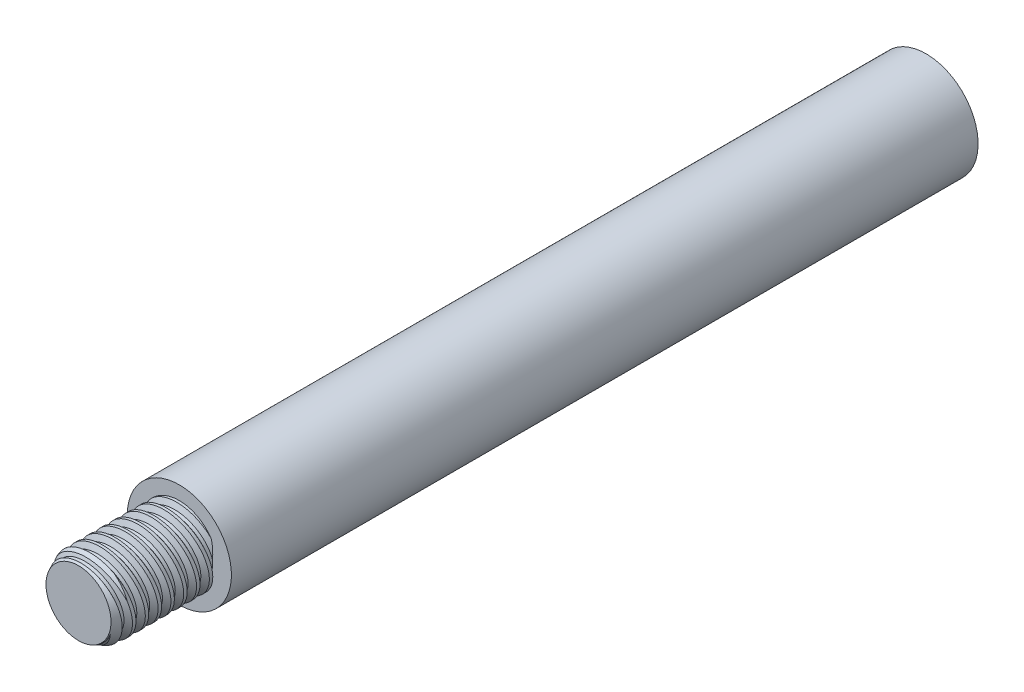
SolidWorks part; units mm, degrees
ref_plane "Front" through (0, 0, 0) normal (0, 0, 1) x (1, 0, 0)
ref_plane "Top" through (0, 0, 0) normal (0, 1, 0) x (1, 0, 0)
ref_plane "Right" through (0, 0, 0) normal (1, 0, 0) x (0, 0, -1)
sketch "Sketch1" plane through (0, 0, 0) normal (1, 0, 0) x (0, 0, -1)
  line L0 (-77.851, 0) -> (77.851, 0) construction
  line L1 (-77.851, 0) -> (-77.851, -25.4) construction
  line L2 (-27.813, 0) -> (-27.813, -9.525) construction
  line L3 (77.851, -25.4) -> (77.851, 0) construction
  line L4 (69.977, 0) -> (69.977, 9.525)
  line L5 (-19.939, 4.214) -> (-19.939, 9.525)
  line L6 (-69.977, 0) -> (-69.977, 4.064) construction
  line L7 (-69.977, 4.064) -> (-19.939, 4.064) construction
  line L8 (-19.939, 9.525) -> (69.977, 9.525)
  line L9 (-77.851, -25.4) -> (-19.939, -25.4) construction
  line L10 (-19.939, -25.4) -> (77.851, -25.4) construction
  line L11 (38.3667, 0) -> (69.977, 0)
  line L12 (-19.939, 4.214) -> (30.099, 4.214)
  line L13 (30.099, 4.214) -> (30.099, 0) construction
  line L14 (30.099, 4.214) -> (38.3667, 4.214)
  line L15 (38.3667, 4.214) -> (38.3667, 0)
  line L16 (-19.939, 4.214) -> (-19.939, 4.064) construction
  line L17 (-19.939, -9.525) -> (69.977, -9.525) construction
  line L18 (-69.977, -4.064) -> (-19.939, -4.064) construction
  line L19 (-19.939, 4.064) -> (-19.939, -9.525) construction
  line L20 (-19.939, -9.525) -> (-27.813, -9.525) construction
  line L21 (-19.939, -9.525) -> (-19.939, -25.4) construction
  point P9 (28.956, -25.4)
revolve "Revolve1" add sketch "Sketch1" angle 360 about L0
ref_plane "Plane1" through (0, 0, -28.956) normal (0, 0, 1) x (1, 0, 0)
fillet "Fillet2" radius 1.0622 2 edges at (9.525, 0, -69.977) (9.525, 0, 19.939)
sketch "Sketch2" plane through (0, 0, 0) normal (1, 0, 0) x (0, 0, -1)
  line L0 (77.851, 3) -> (69.977, 3)
  line L1 (69.977, 0) -> (129.3293, 0) construction
  line L2 (69.977, 0) -> (69.977, 3)
  line L3 (69.977, 0) -> (77.851, 0)
  line L5 (69.977, 0) -> (69.977, 9.525) construction
  line L8 (69.977, 0) -> (69.977, -3) construction
  line L10 (77.851, 3) -> (77.851, 0)
  line L12 (77.851, -3) -> (69.977, -3) construction
  line L13 (77.851, -25.4) -> (77.851, 0) construction
  dimension "Thread Dia" = 6
revolve "Revolve2" add sketch "Sketch2" angle 360 about L1
sketch "Sketch12" plane through (0, 0, 0) normal (1, 0, 0) x (0, 0, -1)
  line L0 (69.977, 3) -> (69.977, -3) construction
  line L1 (69.977, -3) -> (70.977, -3) construction
  line L2 (70.977, -3) -> (69.977, 3) construction
  line L3 (69.977, 3) -> (70.1003, 3.0205) construction
  line L4 (70.1003, 3.0205) -> (70.9634, 3.1644)
  line L5 (70.9634, 3.1644) -> (70.7441, 2.5791)
  line L6 (70.7441, 2.5791) -> (70.4975, 2.538)
  line L7 (70.4975, 2.538) -> (70.1003, 3.0205)
  line L8 (70.5318, 3.0925) -> (70.6208, 2.5586) construction
  line L9 (69.977, 3) -> (70.5473, 3) construction
  line L10 (70.5473, 3) -> (71.5473, -3) construction
  line L11 (71.5473, -3) -> (70.977, -3) construction
  line L12 (69.977, -0.1784) -> (72.1175, 0.1784) construction
  line L13 (77.851, -3) -> (69.977, -3) construction
  line L14 (77.851, 3) -> (69.977, 3) construction
  line L15 (69.977, 0) -> (69.977, 3) construction
  point P13 (71.0473, 0)
revolve "Cut-Revolve1" cut sketch "Sketch12" angle 360 about L12
sketch "Sketch13" plane through (0, 0, 0) normal (1, 0, 0) x (0, 0, -1)
  line L0 (76.8603, 3) -> (77.851, 3)
  line L1 (77.851, 3) -> (77.851, 2.538)
  line L2 (77.851, 2.538) -> (76.8603, 3)
  line L3 (77.851, 3) -> (69.977, 3) construction
  line L4 (77.851, 3) -> (77.851, 0) construction
  line L5 (70.4975, 2.538) -> (77.851, 2.538) construction
  line L6 (69.977, 0) -> (77.851, 0) construction
  line L7 (69.977, 0) -> (77.851, 0) construction
  dimension "D1" = 25
revolve "Cut-Revolve2" cut sketch "Sketch13" angle 360 about L7
pattern_linear "LPattern4" count 2 spacing 1 along (0, 0, 1) count 8 spacing 1 along (0, 0, -1) of "Cut-Revolve1"
sketch "Sketch9" plane through (0, 0, 0) normal (1, 0, 0) x (0, 0, -1)
  line L0 (-69.977, 0) -> (-69.977, 4.064) construction
  line L2 (-69.977, 0) -> (-69.977, 4.064)
  line L3 (-69.977, 4.064) -> (-11.6713, 4.064)
  line L4 (-11.6713, 4.064) -> (-11.6713, 0)
  line L5 (-11.6713, 0) -> (-69.977, 0)
  line L6 (-69.977, 0) -> (-77.851, 0) construction
  line L8 (-11.6713, 2.032) -> (-19.939, 2.032) construction
  line L9 (-19.939, 2.032) -> (-19.939, 4.064) construction
  line L10 (30.099, 4.214) -> (38.3667, 4.214) construction
revolve "Revolve5" add sketch "Sketch9" angle 360 about L6
sketch "Sketch15" plane through (0, 0, 0) normal (1, 0, 0) x (0, 0, -1)
  line L0 (-77.851, 0) -> (-77.851, -25.4) construction
  line L1 (-69.977, 0) -> (-77.851, 0)
  line L2 (-69.977, 0) -> (-69.977, 3)
  line L3 (-69.977, 3) -> (-77.851, 3)
  line L4 (-77.851, 0) -> (-77.851, 3)
  line L5 (77.851, 3) -> (69.977, 3) construction
  line L6 (-69.977, 0) -> (-66.977, 0) construction
  line L7 (-69.977, -3) -> (-77.851, -3) construction
revolve "Revolve6" add sketch "Sketch15" angle 360 about L6
sketch "Sketch16" plane through (0, 0, 0) normal (1, 0, 0) x (0, 0, -1)
  line L0 (-69.977, -3) -> (-69.977, 3) construction
  line L1 (-69.977, 3) -> (-70.977, 3) construction
  line L2 (-70.977, 3) -> (-69.977, -3) construction
  line L3 (-69.977, -3) -> (-70.1003, -3.0205) construction
  line L4 (-70.1003, -3.0205) -> (-70.9634, -3.1644)
  line L5 (-70.9634, -3.1644) -> (-70.7441, -2.5791)
  line L6 (-70.7441, -2.5791) -> (-70.4975, -2.538)
  line L7 (-70.4975, -2.538) -> (-70.1003, -3.0205)
  line L8 (-70.6208, -2.5586) -> (-70.5318, -3.0925) construction
  line L9 (-69.977, -3) -> (-70.5473, -3) construction
  line L10 (-70.5473, -3) -> (-71.5473, 3) construction
  line L11 (-71.5473, 3) -> (-70.977, 3) construction
  line L12 (-69.977, -3) -> (-77.851, -3) construction
  line L13 (-69.977, 3) -> (-77.851, 3) construction
  line L14 (-69.977, 0.1784) -> (-72.1175, -0.1784) construction
  line L16 (-69.977, 0) -> (-69.977, 3) construction
  point P17 (-71.0473, 0)
revolve "Cut-Revolve3" cut sketch "Sketch16" angle 360 about L14
sketch "Sketch17" plane through (0, 0, 0) normal (1, 0, 0) x (0, 0, -1)
  line L0 (-76.8603, -3) -> (-77.851, -3)
  line L1 (-77.851, -3) -> (-77.851, -2.538)
  line L2 (-77.851, -2.538) -> (-76.8603, -3)
  line L5 (-69.977, -3) -> (-77.851, -3) construction
  line L6 (-77.851, 0) -> (-77.851, 3) construction
  line L7 (-70.4975, -2.538) -> (-77.851, -2.538) construction
  line L8 (-69.977, 0) -> (-77.851, 0) construction
  line L9 (-69.977, 0) -> (-77.851, 0) construction
  dimension "D1" = 25
revolve "Cut-Revolve4" cut sketch "Sketch17" angle 360 about L9
pattern_linear "LPattern5" count 2 spacing 1 along (0, 0, -1) count 8 spacing 1 along (0, 0, 1) of "Cut-Revolve3"
combine bodies "Combine3" operation type add bodies to combine 143 108
combine bodies "Combine4" operation type add bodies to combine 148 122
pattern_linear "LPattern2" count 2 spacing 50.038 along (0, 0, -1)
sketch "Sketch14" plane through (0, 0, 0) normal (1, 0, 0) x (0, 0, -1)
  line L2 (-19.939, 3) -> (-20.1547, 3) construction
  line L3 (-20.1547, 3) -> (-20.3124, 2.5791) construction
  line L4 (-20.3124, 2.5791) -> (-20.559, 2.538) construction
  line L5 (-20.559, 2.538) -> (-20.9393, 3) construction
  line L10 (-20.9393, 3) -> (-21.1547, 3) construction
  line L11 (-21.1547, 3) -> (-21.3124, 2.5791) construction
  line L12 (-21.3124, 2.5791) -> (-21.559, 2.538) construction
  line L13 (-21.559, 2.538) -> (-21.9393, 3) construction
  line L14 (-21.9393, 3) -> (-22.1547, 3) construction
  line L15 (-22.1547, 3) -> (-22.3124, 2.5791) construction
  line L16 (-22.3124, 2.5791) -> (-22.559, 2.538) construction
  line L17 (-22.559, 2.538) -> (-22.9393, 3) construction
  line L18 (-22.9393, 3) -> (-23.1547, 3) construction
  line L19 (-23.1547, 3) -> (-23.3124, 2.5791) construction
  line L20 (-23.3124, 2.5791) -> (-23.559, 2.538) construction
  line L21 (-23.559, 2.538) -> (-23.9393, 3) construction
  line L22 (-23.9393, 3) -> (-24.1547, 3) construction
  line L23 (-24.1547, 3) -> (-24.3124, 2.5791) construction
  line L24 (-24.3124, 2.5791) -> (-24.559, 2.538) construction
  line L25 (-24.559, 2.538) -> (-24.9393, 3) construction
  line L26 (-24.9393, 3) -> (-25.1547, 3) construction
  line L27 (-25.1547, 3) -> (-25.3124, 2.5791) construction
  line L28 (-25.3124, 2.5791) -> (-25.559, 2.538) construction
  line L29 (-25.559, 2.538) -> (-25.9393, 3) construction
  line L43 (-25.9393, 3) -> (-26.1547, 3) construction
  line L44 (-26.1547, 3) -> (-26.3124, 2.5791) construction
  line L45 (-26.3124, 2.5791) -> (-26.559, 2.538) construction
  line L46 (-26.559, 2.538) -> (-26.9068, 2.9606) construction
  line L47 (-26.9068, 2.9606) -> (-27.2251, 2.8122) construction
  line L48 (-27.2251, 2.8122) -> (-27.3124, 2.5791) construction
  line L49 (-27.3124, 2.5791) -> (-27.559, 2.538) construction
  line L50 (-27.559, 2.538) -> (-27.6294, 2.6236) construction
  line L51 (-27.6294, 2.6236) -> (-27.813, 2.538) construction
  line L52 (-19.939, 3) -> (-20.1547, 3)
  line L53 (-20.1547, 3) -> (-20.3124, 2.5791)
  line L54 (-20.3124, 2.5791) -> (-20.559, 2.538)
  line L55 (-20.559, 2.538) -> (-20.9393, 3)
  line L56 (-20.9393, 3) -> (-21.1547, 3)
  line L57 (-21.1547, 3) -> (-21.3124, 2.5791)
  line L58 (-21.3124, 2.5791) -> (-21.559, 2.538)
  line L59 (-21.559, 2.538) -> (-21.9393, 3)
  line L60 (-21.9393, 3) -> (-22.1547, 3)
  line L61 (-22.1547, 3) -> (-22.3124, 2.5791)
  line L62 (-22.3124, 2.5791) -> (-22.559, 2.538)
  line L63 (-22.559, 2.538) -> (-22.9393, 3)
  line L64 (-22.9393, 3) -> (-23.1547, 3)
  line L65 (-23.1547, 3) -> (-23.3124, 2.5791)
  line L66 (-23.3124, 2.5791) -> (-23.559, 2.538)
  line L67 (-23.559, 2.538) -> (-23.9393, 3)
  line L68 (-23.9393, 3) -> (-24.1547, 3)
  line L69 (-24.1547, 3) -> (-24.3124, 2.5791)
  line L70 (-24.3124, 2.5791) -> (-24.559, 2.538)
  line L71 (-24.559, 2.538) -> (-24.9393, 3)
  line L72 (-24.9393, 3) -> (-25.1547, 3)
  line L73 (-25.1547, 3) -> (-25.3124, 2.5791)
  line L74 (-25.3124, 2.5791) -> (-25.559, 2.538)
  line L76 (-25.559, 2.538) -> (-25.9393, 3)
  line L77 (-25.9393, 3) -> (-26.1547, 3)
  line L78 (-26.1547, 3) -> (-26.3124, 2.5791)
  line L79 (-26.3124, 2.5791) -> (-26.559, 2.538)
  line L80 (-26.559, 2.538) -> (-26.9068, 2.9606)
  line L81 (-26.9068, 2.9606) -> (-27.2251, 2.8122)
  line L82 (-27.2251, 2.8122) -> (-27.3124, 2.5791)
  line L83 (-27.3124, 2.5791) -> (-27.559, 2.538)
  line L84 (-27.559, 2.538) -> (-27.6294, 2.6236)
  line L94 (-27.6294, 2.6236) -> (-27.813, 2.538)
  line L95 (-27.813, 2.538) -> (-27.813, -2.538) construction
  line L96 (-26.7061, -2.5791) -> (-26.4595, -2.538) construction
  line L97 (-26.8576, -2.9835) -> (-26.7061, -2.5791) construction
  line L98 (-27.2393, -2.8055) -> (-26.8576, -2.9835) construction
  line L99 (-27.4595, -2.538) -> (-27.2393, -2.8055) construction
  line L100 (-27.7061, -2.5791) -> (-27.4595, -2.538) construction
  line L108 (-27.813, -2.538) -> (-27.709, -2.5865) construction
  line L109 (-27.813, 2.538) -> (-27.813, -2.538)
  line L110 (-26.7061, -2.5791) -> (-26.4595, -2.538)
  line L111 (-26.8576, -2.9835) -> (-26.7061, -2.5791)
  line L112 (-27.2393, -2.8055) -> (-26.8576, -2.9835)
  line L113 (-27.4595, -2.538) -> (-27.2393, -2.8055)
  line L115 (-27.7061, -2.5791) -> (-27.4595, -2.538)
  line L116 (-27.813, -2.538) -> (-27.709, -2.5865)
  line L117 (-23.4595, -2.538) -> (-23.0792, -3) construction
  line L118 (-23.7061, -2.5791) -> (-23.4595, -2.538) construction
  line L119 (-23.8638, -3) -> (-23.7061, -2.5791) construction
  line L120 (-24.0792, -3) -> (-23.8638, -3) construction
  line L121 (-24.4595, -2.538) -> (-24.0792, -3) construction
  line L122 (-24.7061, -2.5791) -> (-24.4595, -2.538) construction
  line L123 (-24.8638, -3) -> (-24.7061, -2.5791) construction
  line L124 (-25.0792, -3) -> (-24.8638, -3) construction
  line L125 (-25.4595, -2.538) -> (-25.0792, -3) construction
  line L126 (-25.7061, -2.5791) -> (-25.4595, -2.538) construction
  line L127 (-25.8638, -3) -> (-25.7061, -2.5791) construction
  line L128 (-26.0792, -3) -> (-25.8638, -3) construction
  line L129 (-26.4595, -2.538) -> (-26.0792, -3) construction
  line L130 (-23.4595, -2.538) -> (-23.0792, -3)
  line L131 (-23.7061, -2.5791) -> (-23.4595, -2.538)
  line L132 (-23.8638, -3) -> (-23.7061, -2.5791)
  line L133 (-24.0792, -3) -> (-23.8638, -3)
  line L134 (-24.4595, -2.538) -> (-24.0792, -3)
  line L135 (-24.7061, -2.5791) -> (-24.4595, -2.538)
  line L136 (-24.8638, -3) -> (-24.7061, -2.5791)
  line L137 (-25.0792, -3) -> (-24.8638, -3)
  line L138 (-25.4595, -2.538) -> (-25.0792, -3)
  line L139 (-25.7061, -2.5791) -> (-25.4595, -2.538)
  line L140 (-25.8638, -3) -> (-25.7061, -2.5791)
  line L141 (-26.0792, -3) -> (-25.8638, -3)
  line L142 (-26.4595, -2.538) -> (-26.0792, -3)
  line L143 (-20.0792, -3) -> (-19.939, -3) construction
  line L144 (-20.4595, -2.538) -> (-20.0792, -3) construction
  line L145 (-20.7061, -2.5791) -> (-20.4595, -2.538) construction
  line L146 (-20.8638, -3) -> (-20.7061, -2.5791) construction
  line L147 (-21.0792, -3) -> (-20.8638, -3) construction
  line L148 (-21.4595, -2.538) -> (-21.0792, -3) construction
  line L152 (-21.7061, -2.5791) -> (-21.4595, -2.538) construction
  line L154 (-21.8638, -3) -> (-21.7061, -2.5791) construction
  line L157 (-22.0792, -3) -> (-21.8638, -3) construction
  line L160 (-22.4595, -2.538) -> (-22.0792, -3) construction
  line L165 (-22.7061, -2.5791) -> (-22.4595, -2.538) construction
  line L166 (-22.8638, -3) -> (-22.7061, -2.5791) construction
  line L167 (-23.0792, -3) -> (-22.8638, -3) construction
  line L168 (-20.0792, -3) -> (-19.939, -3)
  line L169 (-20.4595, -2.538) -> (-20.0792, -3)
  line L170 (-20.7061, -2.5791) -> (-20.4595, -2.538)
  line L171 (-20.8638, -3) -> (-20.7061, -2.5791)
  line L172 (-21.0792, -3) -> (-20.8638, -3)
  line L173 (-21.4595, -2.538) -> (-21.0792, -3)
  line L174 (-21.7061, -2.5791) -> (-21.4595, -2.538)
  line L175 (-21.8638, -3) -> (-21.7061, -2.5791)
  line L176 (-22.0792, -3) -> (-21.8638, -3)
  line L190 (-22.4595, -2.538) -> (-22.0792, -3)
  line L191 (-22.7061, -2.5791) -> (-22.4595, -2.538)
  line L192 (-22.8638, -3) -> (-22.7061, -2.5791)
  line L193 (-23.0792, -3) -> (-22.8638, -3)
  line L194 (-27.559, 2.538) -> (-26.7061, -2.5791) construction
  line L195 (-27.559, 2.538) -> (-26.7061, -2.5791)
  line L196 (-27.3124, 2.5791) -> (-26.4595, -2.538) construction
  line L197 (-27.3124, 2.5791) -> (-26.4595, -2.538)
  line L198 (-24.3124, 2.5791) -> (-23.4595, -2.538) construction
  line L199 (-24.559, 2.538) -> (-23.7061, -2.5791) construction
  line L200 (-25.3124, 2.5791) -> (-24.4595, -2.538) construction
  line L201 (-25.559, 2.538) -> (-24.7061, -2.5791) construction
  line L202 (-26.559, 2.538) -> (-25.7061, -2.5791) construction
  line L216 (-26.3124, 2.5791) -> (-25.4595, -2.538) construction
  line L217 (-24.3124, 2.5791) -> (-23.4595, -2.538)
  line L218 (-24.559, 2.538) -> (-23.7061, -2.5791)
  line L219 (-25.3124, 2.5791) -> (-24.4595, -2.538)
  line L220 (-25.559, 2.538) -> (-24.7061, -2.5791)
  line L221 (-26.559, 2.538) -> (-25.7061, -2.5791)
  line L222 (-26.3124, 2.5791) -> (-25.4595, -2.538)
  line L223 (-19.939, 0.3388) -> (-20.3124, 2.5791) construction
  line L224 (-19.939, -1.1819) -> (-20.559, 2.538) construction
  line L225 (-21.3124, 2.5791) -> (-20.4595, -2.538) construction
  line L226 (-21.559, 2.538) -> (-20.7061, -2.5791) construction
  line L227 (-22.3124, 2.5791) -> (-21.4595, -2.538) construction
  line L228 (-22.559, 2.538) -> (-21.7061, -2.5791) construction
  line L229 (-23.3124, 2.5791) -> (-22.4595, -2.538) construction
  line L230 (-23.559, 2.538) -> (-22.7061, -2.5791) construction
  line L232 (-19.939, 0.3388) -> (-20.3124, 2.5791)
  line L234 (-19.939, -1.1819) -> (-20.559, 2.538)
  line L235 (-21.3124, 2.5791) -> (-20.4595, -2.538)
  line L237 (-21.559, 2.538) -> (-20.7061, -2.5791)
  line L238 (-22.3124, 2.5791) -> (-21.4595, -2.538)
  line L239 (-22.559, 2.538) -> (-21.7061, -2.5791)
  line L240 (-23.3124, 2.5791) -> (-22.4595, -2.538)
  line L242 (-23.559, 2.538) -> (-22.7061, -2.5791)
  line L244 (-27.7212, -0.9682) -> (-27.4595, -2.538) construction
  line L254 (-27.7212, -0.9682) -> (-27.4595, -2.538)
  line L255 (-27.6294, 2.6236) -> (-26.8576, -2.9835)
  line L256 (-27.2393, -2.8055) -> (-27.7212, -0.9682)
  line L257 (-26.0792, -3) -> (-27.2251, 2.8122)
  line L258 (-26.9068, 2.9606) -> (-25.8638, -3)
  line L259 (-25.0792, -3) -> (-26.1547, 3)
  line L260 (-25.9393, 3) -> (-24.8638, -3)
  line L261 (-24.0792, -3) -> (-25.1547, 3)
  line L262 (-24.9393, 3) -> (-23.8638, -3)
  line L268 (-23.0792, -3) -> (-24.1547, 3)
  line L269 (-23.9393, 3) -> (-22.8638, -3)
  line L270 (-22.0792, -3) -> (-23.1547, 3)
  line L271 (-22.9393, 3) -> (-21.8638, -3)
  line L272 (-21.0792, -3) -> (-22.1547, 3)
  line L275 (-21.9393, 3) -> (-20.8638, -3)
  line L276 (-20.0792, -3) -> (-21.1547, 3)
  line L277 (-19.939, 3) -> (-19.939, -3)
  line L278 (-20.9393, 3) -> (-19.939, -3.0018)
  line L279 (-20.1547, 3) -> (-19.939, 1.7057)
  spline S0 degree 3 poles (-132.7896, 1994.7114) (-27.5059, 87.5474) (-27.6575, -9.247) (-27.7245, -2.1726) (-27.7254, -2.0595) (-27.7265, -1.7947) (-27.7266, -1.6473) (-27.6874, 8.2645) (-24.5754, 75.4745) (77.8207, -1998.1707) knots -18.245056 -18.245056 -18.245056 -18.245056 0.25 0.25 0.5 0.5 0.75 0.75 15.934053 15.934053 15.934053 15.934053 only from (-27.7212, -2.4889) to (-27.7212, -0.9682) construction
  spline S2 degree 3 poles (-27.7212, -2.4889) (-27.7218, -2.4367) (-27.7227, -2.3613) (-27.7245, -2.1726) (-27.7254, -2.0595) (-27.7265, -1.7947) (-27.7266, -1.6473) (-27.7254, -1.3262) (-27.7239, -1.1501) (-27.7212, -0.9682) knots 0 0 0 0 0.25 0.25 0.5 0.5 0.75 0.75 1 1 1 1
delete or keep bodies "Body-Delete1" type delete bodies bodies 126
delete or keep bodies "Body-Delete2" type delete bodies bodies 150
equation "\"D1@Fillet2\"= \"D9@Sketch1\" / 5"
equation "\"D3@LPattern2\"=\"C Stroke@Sketch1\""
equation "\"D1@Sketch12\"=\"Thread Pitch@Sketch12\"/8"
equation "\"D2@Sketch12\"=\"Thread Pitch@Sketch12\"/4"
equation "\"D4@Sketch12\"=\"Thread Pitch@Sketch12\""
equation "\"D3@LPattern4\"=\"Thread Pitch@Sketch12\""
equation "\"D4@LPattern4\"=\"Thread Pitch@Sketch12\""
equation "\"D2@LPattern4\"=\"Thread Length@Sketch1\"/\"Thread Pitch@Sketch12\""
equation "\"D5@Sketch16\"=\"D3@Sketch16\""
equation "\"D2@Sketch16\"=\"D3@Sketch16\"/4"
equation "\"D1@Sketch16\"=\"D3@Sketch16\"/8"
equation "\"D4@LPattern5\"=\"Thread Pitch@Sketch12\""
equation "\"D3@LPattern5\"=\"Thread Pitch@Sketch12\""
equation "\"D2@LPattern5\"=\"Rod Thread Length@Sketch1\"/\"Thread Pitch@Sketch12\""
